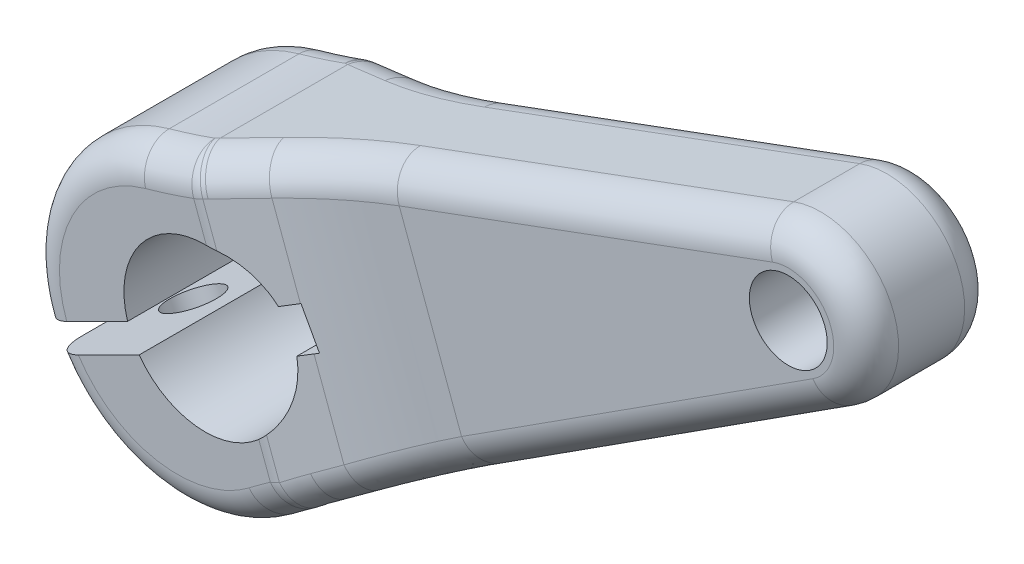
SolidWorks part; units mm, degrees
ref_plane "Plan de face" through (0, 0, 0) normal (0, 0, 1) x (1, 0, 0)
ref_plane "Plan de dessus" through (0, 0, 0) normal (0, 1, 0) x (1, 0, 0)
ref_plane "Plan de droite" through (0, 0, 0) normal (1, 0, 0) x (0, 0, -1)
sketch "Esquisse1" plane through (0, 0, 0) normal (0, 0, 1) x (1, 0, 0)
  line L0 (-86.0288, 433.4864) -> (14.6622, 483.6891) construction
  line L1 (-86.0288, 433.4864) -> (-42.5351, 433.4864) construction
  line L2 (-94.1586, 454.2286) -> (-5.3092, 487.0616)
  line L3 (-74.3559, 414.5107) -> (5.3365, 465.7095)
  line L4 (-97.9638, 429.7706) -> (-111.8399, 422.8338)
  line L5 (-96.179, 426.1909) -> (-110.0525, 419.2554)
  line L7 (-76.5077, 441.5856) -> (-73.8243, 442.9271)
  line L8 (-73.8305, 436.216) -> (-71.1457, 437.5546)
  line L9 (-73.8243, 442.9271) -> (-71.1457, 437.5546)
  arc A0 (-96.179, 426.1909) -> (-73.8305, 436.216) centre (-86.0288, 433.4864) ccw
  arc A1 (-94.1586, 454.2286) -> (-111.8399, 422.8338) centre (-90.279, 431.3673) ccw
  arc A2 (-5.3092, 487.0616) -> (9.5895, 481.1599) centre (-1.1497, 475.8055) cw
  arc A3 (-110.0525, 419.2554) -> (-74.3559, 414.5107) centre (-90.279, 431.3673) ccw
  arc A4 (5.3365, 465.7095) -> (9.5895, 481.1599) centre (-1.1497, 475.8055) ccw
  circle A6 centre (-1.1497, 475.8055) radius 6
  arc A7 (-76.5077, 441.5856) -> (-97.9638, 429.7706) centre (-86.0288, 433.4864) ccw
  dimension "D2" = 12
  dimension "D3" = 12
  dimension "D1" = 26.5
  dimension "D4" = 3
extrude "Boss.-Extru.1" add sketch "Esquisse1" against normal blind 30
fillet "Congé2" radius 100 1 edges at (-94.1586, 454.2286, -15)
fillet "Congé3" radius 100 1 edges at (-74.3559, 414.5107, -15)
fillet "Congé4" radius 5 14 edges at (-94.54, 408.574, -30) (-72.9658, 415.3074, -30) (-111.0542, 441.6669, -30) (-92.6856, 454.8594, -30) (-47.0951, 471.6203, -30) (9.5895, 481.1599, -30) (-94.54, 408.574, 0) (-72.9658, 415.3074, 0) (-111.0542, 441.6669, 0) (-92.6856, 454.8594, 0) (-47.0951, 471.6203, 0) (9.5895, 481.1599, 0) (-32.1428, 441.6307, -30) (-32.1428, 441.6307, 0)
sketch "Esquisse2" plane through (-189.688, 379.4449, 0) normal (-0.4471, 0.8945, 0) x (0.8945, 0.4471, 0)
  line L0 (105.3835, 0) -> (128.3835, 0) construction
  circle A0 centre (97.0773, 15) radius 4
  dimension "D1" = 8
  dimension "D2" = 15
extrude "Enlèv. mat.-Extru.1" cut sketch "Esquisse2" against normal through all and the other way through all
sketch "Esquisse3" plane through (-191.4766, 383.0227, 0) normal (0.4471, -0.8945, 0) x (0.8945, 0.4471, 0)
  circle A0 centre (97.0773, -15) radius 4.75
  dimension "D1" = 9.5
extrude "Enlèv. mat.-Extru.2" cut sketch "Esquisse3" against normal blind 23
ref_plane "Plan4" through (-193.7123, 387.495, 0) normal (0.4471, -0.8945, 0) x (0.8945, 0.4471, 0)
sketch "Esquisse4" plane through (-193.7123, 387.495, 0) normal (0.4471, -0.8945, 0) x (0.8945, 0.4471, 0)
  circle A0 centre (97.0773, -15) radius 7.5
  dimension "D1" = 15
extrude "Enlèv. mat.-Extru.3" cut sketch "Esquisse4" against normal blind 23
sketch "Esquisse5" plane through (-158.999, 430.2678, 0) normal (-0.3466, 0.938, 0) x (0.938, 0.3466, 0)
  line L0 (74.7525, 5) -> (163.8477, 5) construction
  line L1 (180.3659, 25.1793) -> (93.201, 25.1793)
  line L2 (180.3659, 25.1793) -> (180.3659, 47.3475)
  line L3 (180.3659, 47.3475) -> (93.201, 47.3475)
  line L5 (93.201, 5) -> (180.3659, 5)
  line L7 (93.201, -11.4662) -> (180.3659, -11.4662)
  line L8 (180.3659, 5) -> (180.3659, -11.4662)
  line L9 (93.201, 25.1793) -> (74.7525, 30)
  line L10 (74.7525, 30) -> (74.7525, 25) construction
  line L11 (93.201, 5) -> (74.7525, 0)
  line L12 (74.7525, 5) -> (74.7525, 0) construction
  line L13 (74.7525, 0) -> (93.201, -11.4662)
  line L14 (74.7525, 30) -> (93.201, 47.3475)
extrude "Enlèv. mat.-Extru.4" cut sketch "Esquisse5" against normal through all
fillet "Congé5" radius 70 2 edges at (-64.6662, 443.8745, -5) (-64.6662, 443.8745, -25.1793)
fillet "Congé6" radius 5 13 edges at (-76.3103, 422.1616, 0) (-74.4976, 418.8521, -0.1499) (-86.1247, 448.7204, 0) (-68.3073, 419.764, -1.8093) (-85.644, 454.743, -0.688) (-22.1959, 448.0212, -5) (9.5895, 481.1599, -5) (-86.1247, 448.7204, -30) (-76.3103, 422.1616, -30) (-74.5274, 418.8812, -29.8601) (-68.2155, 419.8568, -28.2247) (-56.8461, 425.8072, -25.629) (-34.0726, 476.4325, -5)
